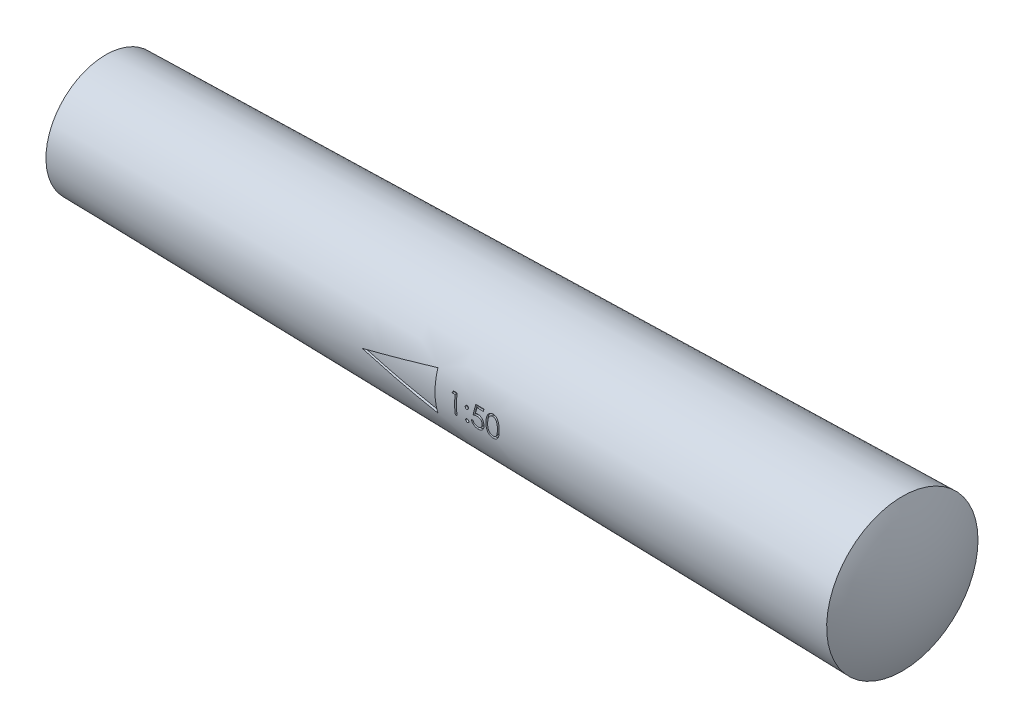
SolidWorks part; units mm, degrees
ref_plane "Front Plane" through (0, 0, 0) normal (0, 0, 1) x (1, 0, 0)
ref_plane "Top Plane" through (0, 0, 0) normal (0, 1, 0) x (1, 0, 0)
ref_plane "Right Plane" through (0, 0, 0) normal (1, 0, 0) x (0, 0, -1)
sketch "Sketch1" plane through (0, 0, 0) normal (1, 0, 0) x (0, 0, -1)
  circle A0 centre (0, 0) radius 3
  dimension "D1" = 6
extrude "Extrude1" add sketch "Sketch1" along normal mid plane 40
draft "Draft1" type of draft neutral plane draft angle 1.146 faces to draft 1 parameters "D1"=1.146
sketch "Sketch2" plane through (0, 0, 0) normal (0, 0, 1) x (1, 0, 0)
  line L0 (-20, 0) -> (-20, 3)
  line L1 (-20, 3) -> (-20, -3) construction
  line L2 (-20, 0) -> (-20.9, 0)
  line L3 (-20.9, 0) -> (-20.9, -3.4) construction
  line L4 (20, 0) -> (20, 3.8)
  line L5 (20, -3.8) -> (20, 3.8) construction
  line L6 (20, 0) -> (20.9, 0)
  line L7 (20.9, 0) -> (20.9, -3.4) construction
  line L8 (-20, -3) -> (20, -3.8) construction
  arc A0 (-20.9, 0) -> (-20, 3) centre (-15.45, 0) cw
  arc A1 (20.9, 0) -> (20, 3.8) centre (12.4277, 0) ccw
  point P14 (0, -3.4)
revolve "Revolve1" add sketch "Sketch2" angle 360 about L2
sketch "Sketch5" plane through (0, 0, 0) normal (0, 0, 1) x (1, 0, 0)
  line L0 (0, 3.4) -> (0, -3.4) construction
  line L1 (20, 3.8) -> (-20, 3) construction
  line L2 (-20, -3) -> (20, -3.8) construction
ref_plane "Plane2" through (0, 0, 0) normal (-0.02, 0, 0.9998) x (0.9998, 0, 0.02)
sketch "Sketch6" plane through (0, 0, 0) normal (-0.02, 0, 0.9998) x (0.9998, 0, 0.02)
  line L0 (0, 0) -> (0, 1)
  line L1 (0, 3.4) -> (0, -3.4) construction
  line L2 (0, 1) -> (-3.7321, 0)
  line L3 (-3.7321, 0) -> (0, -1)
  line L4 (0, -1) -> (0, 0)
  line L5 (0, -0.5) -> (4, -0.5) construction
  text T0 "1:50" font "Century Gothic" height 1
  dimension "D1" = 2
  dimension "D2" = 30
  dimension "D3" = 4
wrap "Wrap2" sketch "Sketch6" wrap type deboss source sketch "Sketch6" thickness 0.1 parameters "D1"=0.1
equation "\"D2@Sketch2\" = \"D1@Sketch2\""
